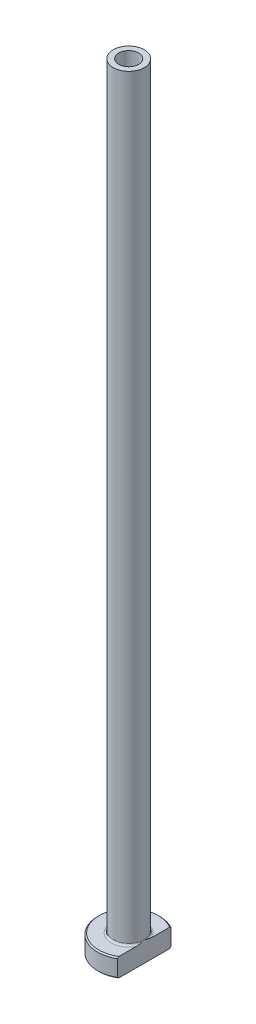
SolidWorks part; units mm, degrees
ref_plane "Front Plane" through (0, 0, 0) normal (0, 0, 1) x (1, 0, 0)
ref_plane "Top Plane" through (0, 0, 0) normal (0, 1, 0) x (1, 0, 0)
ref_plane "Right Plane" through (0, 0, 0) normal (1, 0, 0) x (0, 0, -1)
sketch "Sketch1" plane through (0, 0, 0) normal (0, 0, 1) x (1, 0, 0)
  line L0 (-1.6, 125) -> (-2.5, 125)
  line L1 (-2.5, 125) -> (-2.5, 3)
  line L2 (-2.5, 3) -> (-5, 3)
  line L3 (-5, 3) -> (-5, 0)
  line L4 (4.125, 0) -> (-4.125, 0) construction
  line L5 (-5, 0) -> (-1.85, 0)
  line L6 (-1.6, 80) -> (-1.6, 125)
  line L7 (0, 92.1877) -> (0, -15.5353) construction
  line L8 (0, -5.5) -> (0, 5.5) construction
  line L9 (-1.6, 80) -> (-1.85, 68)
  line L10 (-1.85, 68) -> (-1.85, 0)
  dimension "D1" = 0.25
  dimension "ID" = 3.2
  dimension "OD" = 5
  dimension "L" = 125
  dimension "H" = 10
  dimension "T" = 3
  dimension "N" = 45
  dimension "D2" = 12
  dimension "L-N" = 80
revolve "Revolve1" add sketch "Sketch1" angle 360 about L7
fillet "Fillet1" radius 0.3 1 edges at (0, 3, 2.5)
chamfer "Chamfer1" distance 0.2 angle 45 2 edges at (0, 3, 5) (0, 0, 5)
sketch "Sketch2" plane through (0, 0, 0) normal (0, -1, 0) x (1, 0, 0)
  line L0 (2.5, 4.3301) -> (2.5, -4.3301)
  circle A0 centre (0, 0) radius 5 construction
  arc A1 (2.5, 4.3301) -> (2.5, -4.3301) centre (0, 0) cw
  circle A2 centre (0, 0) radius 2.5 construction
extrude "Cut-Extrude1" cut sketch "Sketch2" against normal through all
chamfer "Chamfer2" distance 0.5 angle 45 1 edges at (0, 0, 1.85)
